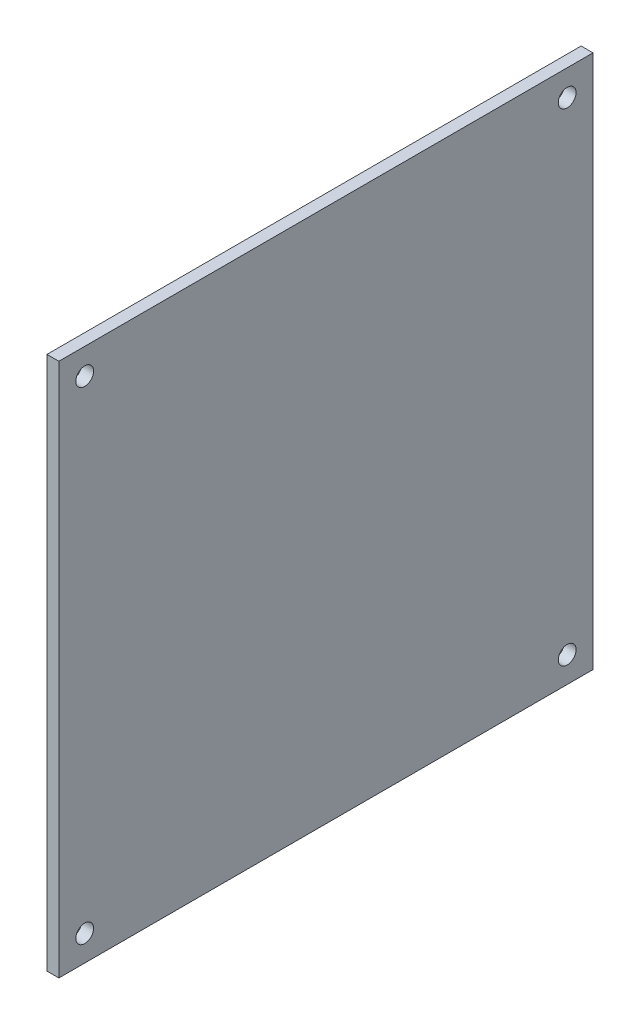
SolidWorks part; units mm, degrees
ref_plane "Front Plane" through (0, 0, 0) normal (0, 0, 1) x (1, 0, 0)
ref_plane "Top Plane" through (0, 0, 0) normal (0, 1, 0) x (1, 0, 0)
ref_plane "Right Plane" through (0, 0, 0) normal (1, 0, 0) x (0, 0, -1)
sketch "Esquisse1" plane through (0, 0, 0) normal (1, 0, 0) x (0, 0, -1)
  line L0 (44.7489, -45.6276) -> (44.7489, 44.3724)
  line L1 (44.7489, 44.3724) -> (-45.2511, 44.3724)
  line L2 (-45.2511, 44.3724) -> (-45.2511, -45.6276)
  line L3 (-45.2511, -45.6276) -> (44.7489, -45.6276)
  circle A0 centre (-40.9011, 40.0201) radius 1.5
  circle A1 centre (40.3989, 40.0224) radius 1.5
  circle A2 centre (40.3989, -41.2776) radius 1.5
  circle A3 centre (-40.9011, -41.2776) radius 1.5
  dimension "D1" = 4.3523
  dimension "D2" = 90
  dimension "D3" = 90
  dimension "D4" = 4.35
  dimension "D5" = 4.35
  dimension "D6" = 4.35
  dimension "D7" = 4.35
  dimension "D8" = 4.35
  dimension "D9" = 4.35
  dimension "D10" = 4.35
extrude "Boss.-Extru.1" add sketch "Esquisse1" along normal blind 2
